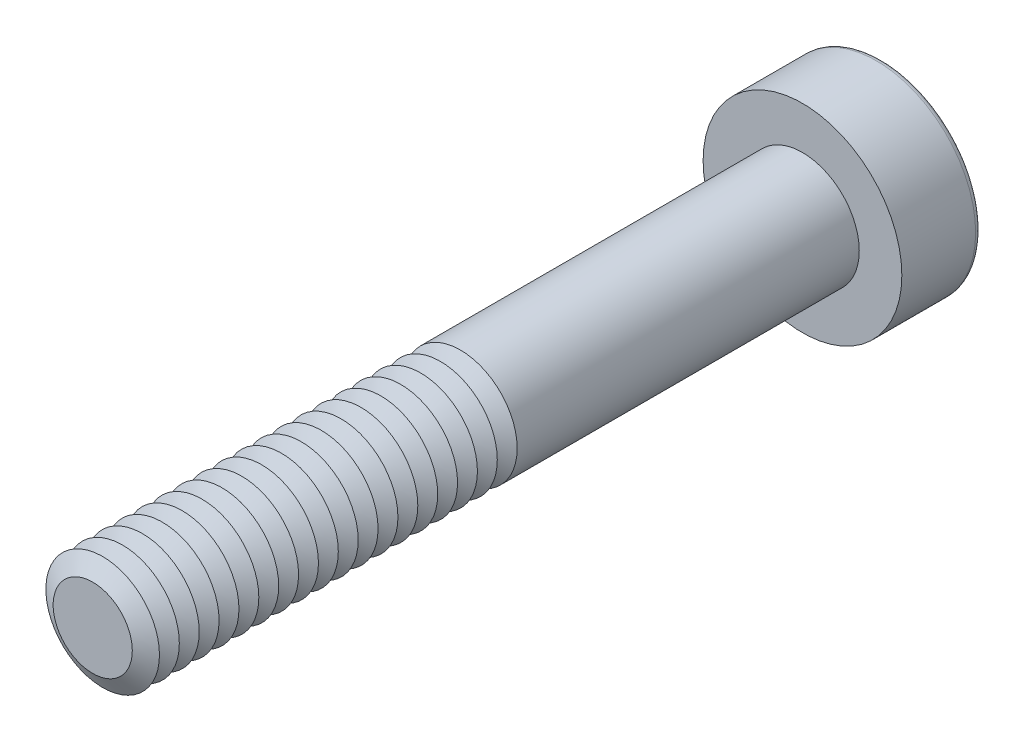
SolidWorks part; units mm, degrees
ref_plane "Front Plane" through (0, 0, 0) normal (0, 0, 1) x (1, 0, 0)
ref_plane "Top Plane" through (0, 0, 0) normal (0, 1, 0) x (1, 0, 0)
ref_plane "Right Plane" through (0, 0, 0) normal (1, 0, 0) x (0, 0, -1)
sketch "Sketch1" plane through (0, 0, 0) normal (0, 0, 1) x (1, 0, 0)
  circle A0 centre (0, 0) radius 2
  dimension "D1" = 4
extrude "Boss-Extrude1" add sketch "Sketch1" along normal blind 25
sketch "Sketch2" plane through (0, 0, 0) normal (0, 0, -1) x (-1, 0, 0)
  circle A0 centre (0, 0) radius 3.5
  dimension "D1" = 7
extrude "Boss-Extrude2" add sketch "Sketch2" along normal blind 2.8
sketch "Sketch3" plane through (0, 0, -2.8) normal (0, 0, -1) x (-1, 0, 0)
  line L1 (-0.7217, 1.25) -> (-1.4434, 0)
  line L2 (-1.4434, 0) -> (-0.7217, -1.25)
  line L3 (-0.7217, -1.25) -> (0.7217, -1.25)
  line L4 (0.7217, -1.25) -> (1.4434, 0)
  line L5 (1.4434, 0) -> (0.7217, 1.25)
  line L6 (0.7217, 1.25) -> (-0.7217, 1.25)
  circle A0 centre (0, 0) radius 1.25 construction
  dimension "D1" = 2.5
extrude "Cut-Extrude1" cut sketch "Sketch3" against normal blind 1.875
fillet "Fillet1" radius 0.2 1 edges at (-3.5, 0, -2.8)
sketch "Sketch4" plane through (0, 0, -0.925) normal (0, 0, -1) x (-1, 0, 0)
  line L0 (0.7217, -1.25) -> (1.4434, 0) construction
  circle A0 centre (0, 0) radius 1.25
extrude "Cut-Extrude2" cut sketch "Sketch4" against normal through all draft 60
sketch "Sketch5" plane through (0, 0, -2.8) normal (0, 0, -1) x (-1, 0, 0)
  circle A0 centre (0, 0) radius 1.4434
extrude "Cut-Extrude3" cut sketch "Sketch5" against normal through all draft 75
sketch "Sketch7" plane through (0, 0, 0) normal (1, 0, 0) x (0, 0, -1)
  line L25 (-25, 1.3938) -> (-24.65, 2)
  line L26 (-25, 2) -> (-25, -2) construction
  line L27 (-24.65, 2) -> (-25.35, 2)
  line L28 (-25.35, 2) -> (-25, 1.3938)
  line L29 (0, 2) -> (-25, 2) construction
  dimension "D1" = 0.7
revolve "Cut-Revolve1" cut sketch "Sketch7" angle 360 about axis through (0, 0, 25) along (0, 0, -1)
pattern_linear "LPattern1" count 19 spacing 0.7 along (0, 0, -1) of "Cut-Revolve1"
